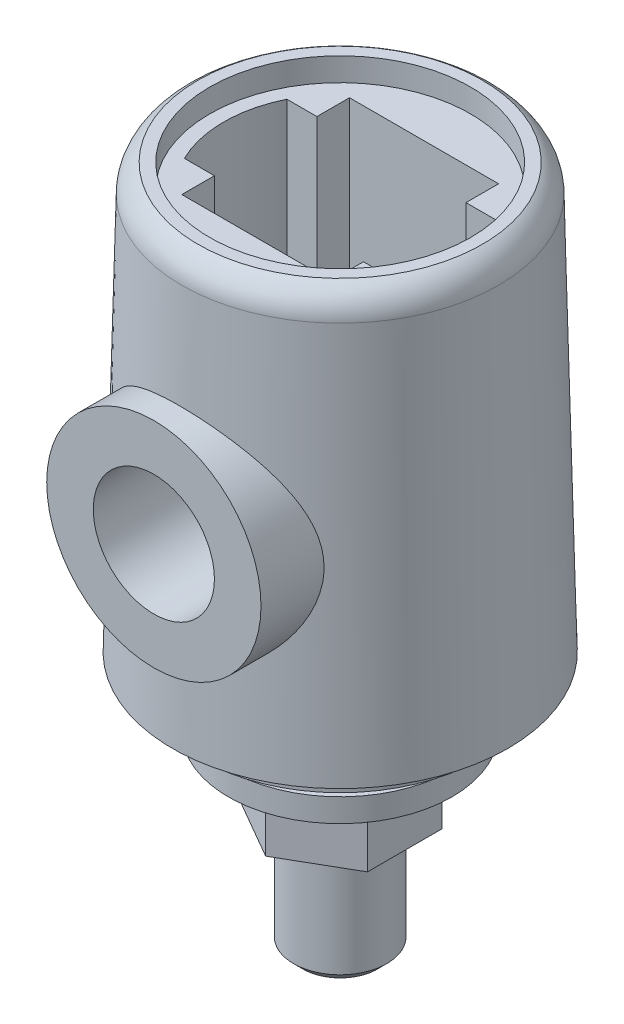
SolidWorks part; units mm, degrees
ref_plane "Plan de face" through (0, 0, 0) normal (0, 0, 1) x (1, 0, 0)
ref_plane "Plan de dessus" through (0, 0, 0) normal (0, 1, 0) x (1, 0, 0)
ref_plane "Plan de droite" through (0, 0, 0) normal (1, 0, 0) x (0, 0, -1)
sketch "Esquisse1" plane through (0, 0, 0) normal (0, 0, 1) x (1, 0, 0)
  line L0 (-8, 19.5) -> (-5, 19.5)
  line L1 (-8, 12.5) -> (-5, 12.5)
  line L2 (-5, 12.5) -> (-5, 1)
  line L5 (0, 106.3403) -> (0, -19.2337) construction
  line L6 (0, 73) -> (0, 0)
  line L40 (-12, 22.5) -> (-12, 20)
  line L42 (-4, 0) -> (0, 0)
  line L44 (-12, 20) -> (-5, 20)
  line L45 (-8, 19.5) -> (-8, 12.5)
  line L46 (-5, 20) -> (-5, 19.5)
  line L48 (-4, 0) -> (-5, 1)
  line L58 (-15, 25) -> (-5, 25)
  line L59 (-18, 27.5) -> (-15, 27.5)
  line L60 (-15.263, 73) -> (0, 73)
  line L63 (-12, 22.5) -> (-5, 22.5)
  line L64 (-18, 27.5) -> (-17, 70.0581)
  line L65 (-15, 27.5) -> (-15, 25)
  line L67 (-5, 25) -> (-5, 22.5)
  arc A14 (-15.263, 73) -> (-17, 70.0581) centre (-13.501, 69.9759) ccw
  dimension "D10" = 3.5
  dimension "D2" = 1
  dimension "D3" = 1
  dimension "D4" = 7
  dimension "D5" = 25
  dimension "D6" = 10
  dimension "D7" = 73
  dimension "D8" = 34
  dimension "D9" = 36
  dimension "D11" = 16
  dimension "D12" = 24
  dimension "D13" = 10
  dimension "D14" = 2.5
  dimension "D15" = 2.5
revolve "Révolution3" add sketch "Esquisse1" angle 360 about L5
sketch "Esquisse4" plane through (0, 12.5, 0) normal (0, -1, 0) x (1, 0, 0)
  line L1 (0, 8) -> (-6.9282, 4)
  line L2 (-6.9282, 4) -> (-6.9282, -4)
  line L3 (-6.9282, -4) -> (0, -8)
  line L4 (0, -8) -> (6.9282, -4)
  line L5 (6.9282, -4) -> (6.9282, 4)
  line L6 (6.9282, 4) -> (0, 8)
  circle A0 centre (0, 0) radius 6.9282 construction
extrude "Enlèv. mat.-Extru.1" cut sketch "Esquisse4" against normal up to surface (7 mm away) flip side to cut
ref_plane "Plan1" through (0, 0, 20) normal (0, 0, 1) x (1, 0, 0)
sketch "Esquisse6" plane through (0, 0, 20) normal (0, 0, 1) x (1, 0, 0)
  line L0 (0, 106.3403) -> (0, -19.2337) construction
  line L1 (-15, 27.5) -> (15, 27.5) construction
  circle A0 centre (0, 47.5) radius 11.5
  dimension "D1" = 23
  dimension "D2" = 20
extrude "Extrusion5" add sketch "Esquisse6" against normal blind 33
sketch "Esquisse7" plane through (0, 0, 20) normal (0, 0, 1) x (1, 0, 0)
  circle A0 centre (0, 47.5) radius 6.5
  circle A1 centre (0, 47.5) radius 11.5 construction
  dimension "D1" = 13
extrude "Enlèv. mat.-Extru.3" cut sketch "Esquisse7" against normal through all
sketch "Esquisse8" plane through (0, 73, 0) normal (0, 1, 0) x (-1, 0, 0)
  circle A0 centre (0, 0) radius 14
  dimension "D1" = 28
extrude "Enlèv. mat.-Extru.4" cut sketch "Esquisse8" against normal blind 2.5
sketch "Esquisse9" plane through (0, 70.5, 0) normal (0, 1, 0) x (-1, 0, 0)
  line L0 (8, 5.5) -> (11.225, 5.5)
  line L1 (-8, 9) -> (8, 9)
  line L2 (-8, 9) -> (-8, 5.5)
  line L3 (-8, -9) -> (8, -9)
  line L4 (8, 9) -> (8, 5.5)
  line L5 (-11.225, 5.5) -> (-8, 5.5)
  line L6 (-8, -5.5) -> (-8, -9)
  line L7 (-11.225, -5.5) -> (-8, -5.5)
  line L9 (8, -5.5) -> (11.225, -5.5)
  line L10 (8, -5.5) -> (8, -9)
  arc A0 (-11.225, 5.5) -> (-11.225, -5.5) centre (0, 0) ccw
  arc A1 (11.225, -5.5) -> (11.225, 5.5) centre (0, 0) ccw
  dimension "D1" = 25
  dimension "D2" = 16
  dimension "D3" = 8
  dimension "D4" = 18
  dimension "D5" = 9
  dimension "D7" = 5.5
extrude "Enlèv. mat.-Extru.5" cut sketch "Esquisse9" against normal blind 42.5
